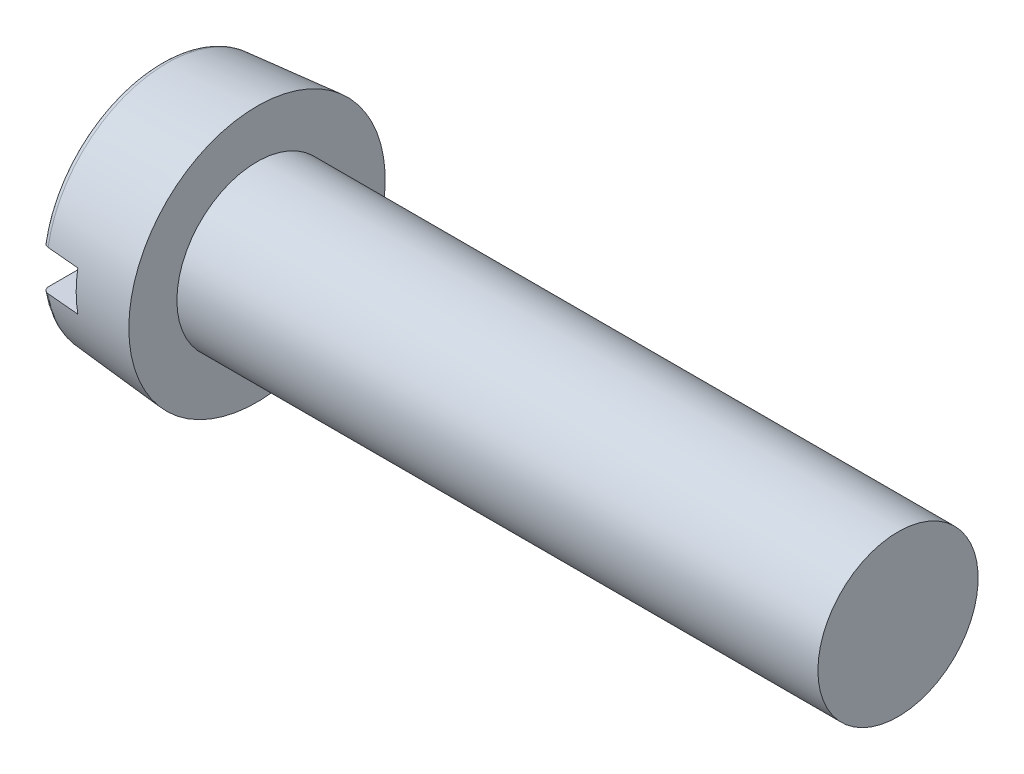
SolidWorks part; units mm, degrees
ref_plane "Plane1" through (0, 0, 0) normal (0, 0, 1) x (1, 0, 0)
ref_plane "Plane2" through (0, 0, 0) normal (0, 1, 0) x (1, 0, 0)
ref_plane "Plane3" through (0, 0, 0) normal (1, 0, 0) x (0, 0, -1)
sketch "BodySke" plane through (0, 0, 0) normal (0, 0, 1) x (1, 0, 0)
  line L0 (6, 5) -> (6, 8)
  line L1 (0, 0) -> (0, 7.4751)
  line L2 (-25.4, 0) -> (127, 0) construction
  line L3 (46, 0) -> (0, 0)
  line L4 (6, 5) -> (46, 5)
  line L5 (46, 5) -> (46, 0)
  line L6 (0, 7.4751) -> (6, 8)
  line L9 (7.5, 6.5875) -> (7.5, -2.9375) construction
  line L10 (6, 6.35) -> (6, -3.175) construction
  dimension "Head_ht" = 6
  dimension "Diameter" = 10
  dimension "Length" = 40
  dimension "Head_dia" = 16
  dimension "Advance" = 1.5
  dimension "Thread_nom" = 40
  dimension "Head_side_angle" = 5
revolve "Base-Revolve" add sketch "BodySke"
fillet "Fillet1" [suppressed] radius 0.4
fillet "Fillet2" radius 0.4 1 edges at (0, 0, 7.4751)
sketch "Sketch2" plane through (0, 0, 0) normal (1, 0, 0) x (0, 0, -1)
  line L0 (8, -1.25) -> (-8, -1.25)
  line L1 (8, -1.25) -> (8, 1.25)
  line L2 (-8, 1.25) -> (8, 1.25)
  line L3 (-8, 1.25) -> (-8, -1.25)
  dimension "D1" = 16
  dimension "D2" = 8
  dimension "Slot_width" = 2.5
  dimension "D3" = 1.25
extrude "Slot" cut sketch "Sketch2" along normal blind 2.4
sketch "ThdSchSke" plane through (0, 0, 0) normal (0, 0, 1) x (1, 0, 0)
  line L0 (9, -4.1885) -> (8.4318, -5)
  line L1 (9, -4.1885) -> (9.5682, -5)
  line L2 (9.5682, -5) -> (9.5682, -6.25)
  line L3 (-3.175, 0) -> (5.1513, 0) construction
  line L5 (9.5682, -6.25) -> (8.4318, -6.25)
  line L6 (8.4318, -6.25) -> (8.4318, -5)
  dimension "Thread_minor" = 8.377
  dimension "Diameter" = 10
  dimension "Start" = 9
  dimension "SideAngle" = 55
  dimension "VeeAngle" = 70
  dimension "Overcut" = 12.5
revolve "ThreadSchematic" [suppressed] cut sketch "ThdSchSke" angle 360 about L3
pattern_linear "ThdSchPat" [suppressed]
equation "\"D1@Sketch2\" = \"Head_dia@BodySke\""
equation "\"D2@Sketch2\" = \"D1@Sketch2\" / 2"
equation "\"D3@Sketch2\" = \"Slot_width@Sketch2\" / 2"
equation "\"Thread_length@ThreadCosmetic\" = ((sgn( (\"Length@BodySke\" - \"Advance@BodySke\" * 2.0 ) - \"Thread_nom@BodySke\" )-1)*( (\"Length@BodySke\" - \"Advance@BodySke\"  * 2.0) - \"Thread_nom@BodySke\" ))/-2+ \"Thread_"
equation "\"Thread_minor@ThdSchSke\" = \"Thread_minor@ThreadCosmetic\""
equation "\"Diameter@ThdSchSke\" = \"Diameter@BodySke\""
equation "\"Overcut@ThdSchSke\" = \"Diameter@BodySke\" * 1.25"
equation "\"Start@ThdSchSke\" = \"Head_ht@BodySke\" + \"Length@BodySke\" - \"Thread_length@ThreadCosmetic\"  '---Non-countersunk---"
equation "\"Num_threads@ThdSchPat\" = int( \"Thread_length@ThreadCosmetic\" / \"Advance@BodySke\" + 0.999 )  + 1"
equation "\"Advance@ThdSchPat\" = \"Thread_length@ThreadCosmetic\" /  (\"Num_threads@ThdSchPat\" - 1) 'relax it"
